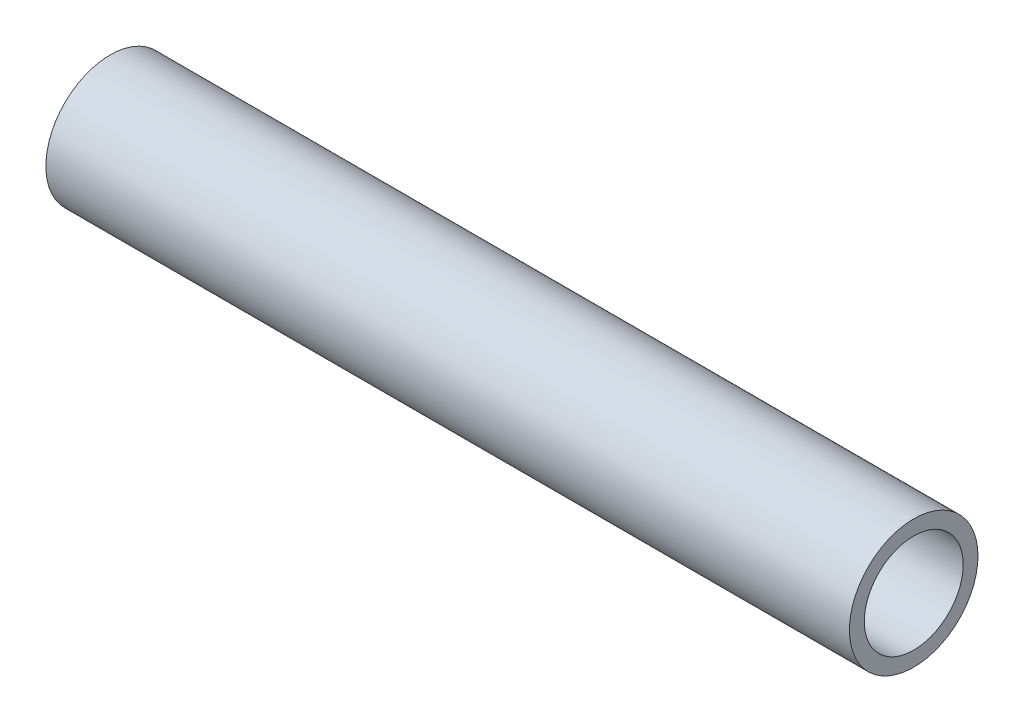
SolidWorks part; units mm, degrees
ref_plane "Front" through (0, 0, 0) normal (0, 0, 1) x (1, 0, 0)
ref_plane "Top" through (0, 0, 0) normal (0, 1, 0) x (1, 0, 0)
ref_plane "Right" through (0, 0, 0) normal (1, 0, 0) x (0, 0, -1)
sketch "Sketch1" plane through (0, 0, 0) normal (0, 0, 1) x (1, 0, 0)
  line L0 (0, 0) -> (206.375, 0)
  line L1 (9.9848, 0) -> (-9.9848, 0) construction
  dimension "D1" = 206.375
other "Structural Member1"
ref_plane "Plane1" through (0, 0, 0) normal (1, 0, 0) x (0, 0, -1)
sketch "Sketch11" plane through (0, 0, 0) normal (1, 0, 0) x (0, 0, -1)
  circle A0 centre (0, 0) radius 12.7
  circle A1 centre (0, 0) radius 16.51
  point P3 (0, 0)
  dimension "D1" = 33.02
  dimension "D2" = 25.4
